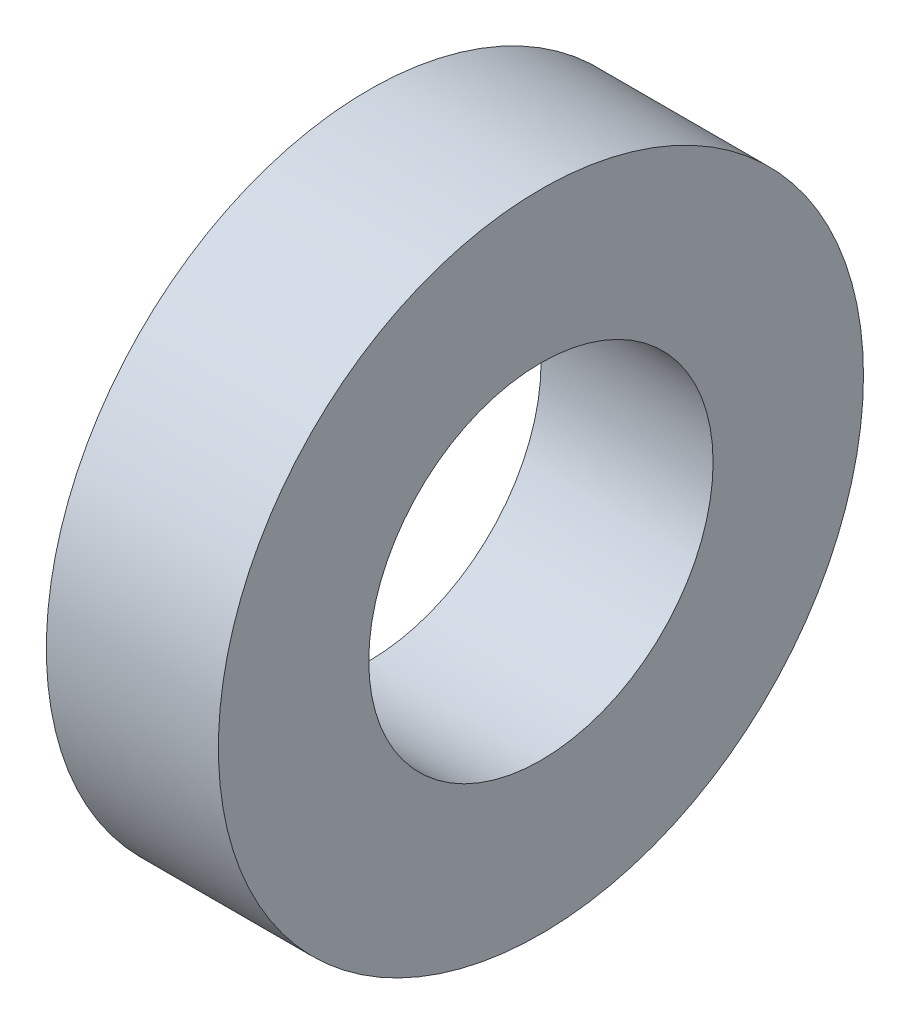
SolidWorks part; units mm, degrees
ref_plane "Piano frontale" through (0, 0, 0) normal (0, 0, 1) x (1, 0, 0)
ref_plane "Piano superiore" through (0, 0, 0) normal (0, 1, 0) x (1, 0, 0)
ref_plane "Piano destro" through (0, 0, 0) normal (1, 0, 0) x (0, 0, -1)
sketch "Schizzo1" plane through (0, 0, 0) normal (1, 0, 0) x (0, 0, -1)
  circle A0 centre (0, 0) radius 4.0029
  circle A1 centre (0, 0) radius 7.4996
extrude "Estrusione-Estrusione1" add sketch "Schizzo1" along normal blind 4
